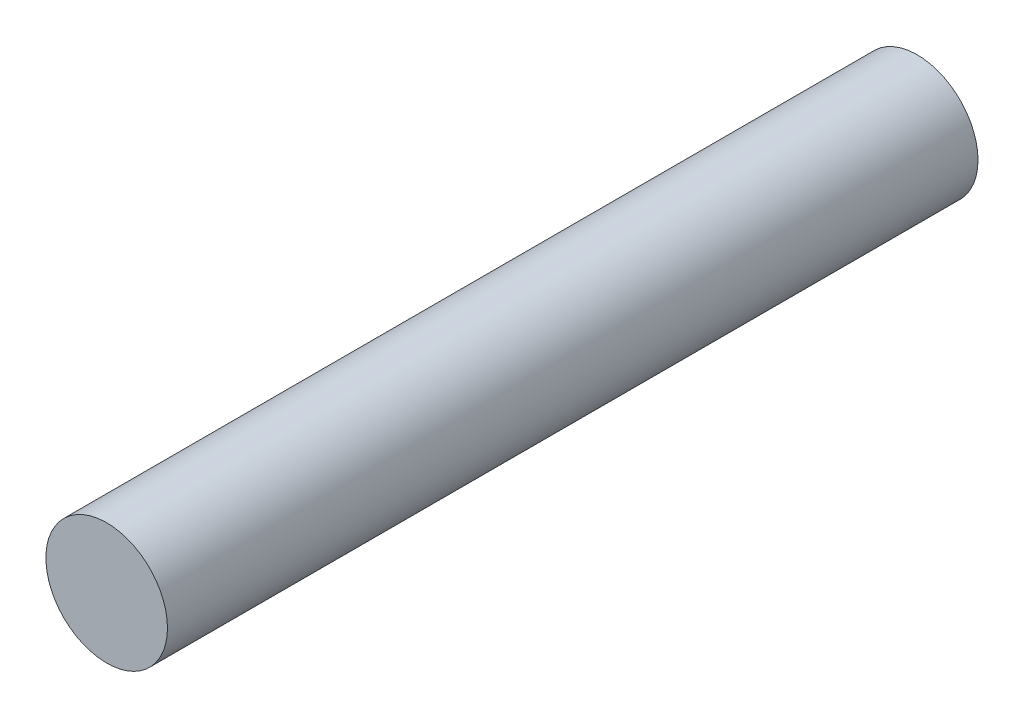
SolidWorks part; units mm, degrees
ref_plane "Plan de face" through (0, 0, 0) normal (0, 0, 1) x (1, 0, 0)
ref_plane "Plan de dessus" through (0, 0, 0) normal (0, 1, 0) x (1, 0, 0)
ref_plane "Plan de droite" through (0, 0, 0) normal (1, 0, 0) x (0, 0, -1)
sketch "Esquisse1" plane through (0, 0, 0) normal (0, 0, 1) x (1, 0, 0)
  circle A0 centre (0, 0) radius 1.5
  dimension "D1" = 3
extrude "Extrusion1" add sketch "Esquisse1" along normal blind 20
